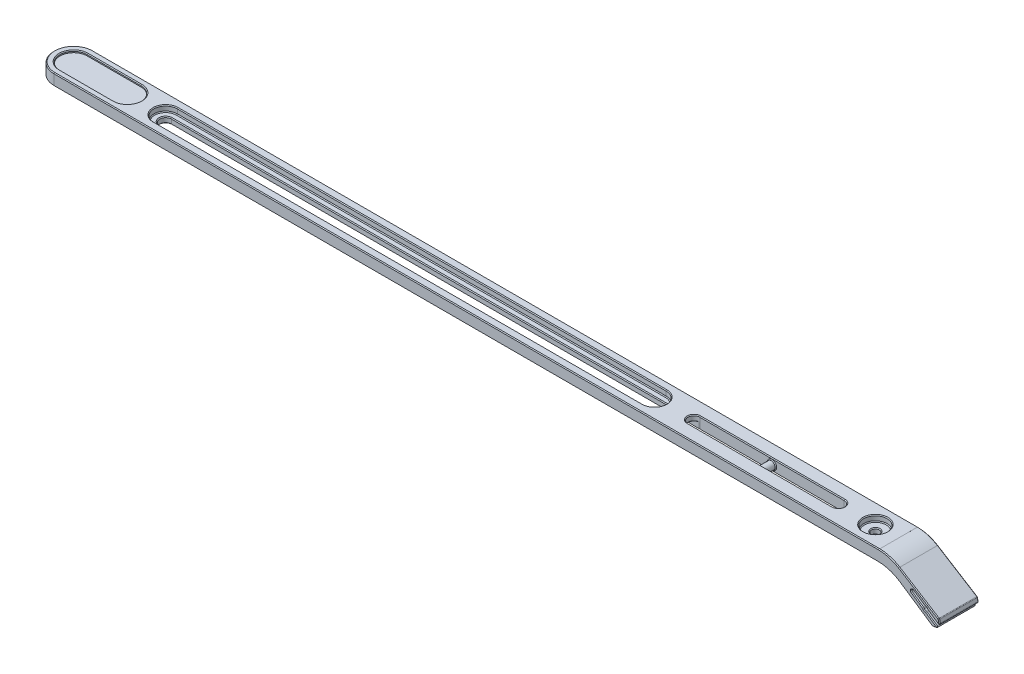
SolidWorks part; units mm, degrees
other "<完成零件小的>-<倒角40>"
ref_plane "前视基准面" through (0, 0, 0) normal (0, 0, 1) x (1, 0, 0)
ref_plane "上视基准面" through (0, 0, 0) normal (0, 1, 0) x (1, 0, 0)
ref_plane "右视基准面" through (0, 0, 0) normal (1, 0, 0) x (0, 0, -1)
mirrored part "小架子_镜向"
